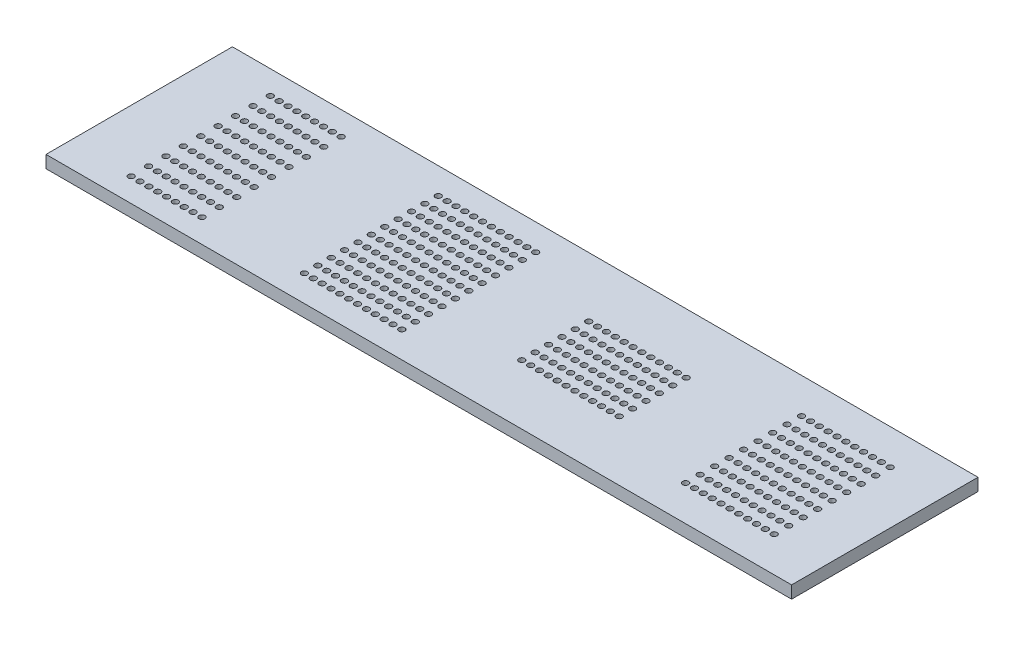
SolidWorks part; units mm, degrees
ref_plane "Plan de face" through (0, 0, 0) normal (0, 0, 1) x (1, 0, 0)
ref_plane "Plan de dessus" through (0, 0, 0) normal (0, 1, 0) x (1, 0, 0)
ref_plane "Plan de droite" through (0, 0, 0) normal (1, 0, 0) x (0, 0, -1)
sketch "Esquisse2" plane through (0, 0, 0) normal (0, 1, 0) x (1, 0, 0)
  line L1 (-60, -15) -> (60, -15)
  line L2 (-60, -15) -> (-60, 15)
  line L3 (-60, 15) -> (60, 15)
  line L4 (60, -15) -> (60, 15)
  line L5 (-60, -15) -> (60, 15) construction
  line L6 (-60, 15) -> (60, -15) construction
  point P0 (0, 0)
  dimension "D1" = 30
  dimension "D2" = 120
extrude "Boss.-Extru.1" add sketch "Esquisse2" along normal blind 2 contours L3 L4 L1 L2
sketch "Cavités" plane through (0, 0, 0) normal (0, 1, 0) x (1, 0, 0)
  line L0 (-60, -15) -> (60, -15) construction
  line L1 (-58.4, 15) -> (-30.4, 15) construction
  line L2 (-58.4, 15) -> (-58.4, -15) construction
  line L3 (-58.4, -15) -> (-30.4, -15) construction
  line L4 (-30.4, 15) -> (-30.4, -15) construction
  line L5 (-60, 15) -> (60, 15) construction
  line L6 (-28.8, 15) -> (-0.8, 15) construction
  line L7 (-28.8, 15) -> (-28.8, -15) construction
  line L8 (-28.8, -15) -> (-0.8, -15) construction
  line L9 (-0.8, 15) -> (-0.8, -15) construction
  line L10 (-30.4, 15) -> (-28.8, 15) construction
  line L11 (0.8, 15) -> (28.8, 15) construction
  line L12 (0.8, 15) -> (0.8, -15) construction
  line L13 (0.8, -15) -> (28.8, -15) construction
  line L14 (28.8, 15) -> (28.8, -15) construction
  line L15 (30.4, 15) -> (58.4, 15) construction
  line L16 (30.4, 15) -> (30.4, -15) construction
  line L17 (30.4, -15) -> (58.4, -15) construction
  line L18 (58.4, 15) -> (58.4, -15) construction
  line L19 (-0.8, 15) -> (0.8, 15) construction
  line L20 (28.8, 15) -> (30.4, 15) construction
  line L21 (-60, 15) -> (-58.4, 15) construction
  line L22 (58.4, 15) -> (60, 15) construction
  dimension "D1" = 28
  dimension "D2" = 1.6
sketch "Esquisse7" plane through (0, 2, 0) normal (0, 1, 0) x (1, 0, 0)
  line L0 (-58.4, 0) -> (-50.096, 0) construction
  line L1 (-50.096, 11.2) -> (-38.704, 11.2) construction
  line L2 (-50.096, 11.2) -> (-50.096, -11.2) construction
  line L3 (-50.096, -11.2) -> (-38.704, -11.2) construction
  line L4 (-38.704, 11.2) -> (-38.704, -11.2) construction
  line L5 (-58.4, 15) -> (-58.4, -15) construction
  line L6 (-38.704, 0) -> (-30.4, 0) construction
  line L7 (-30.4, 15) -> (-30.4, -15) construction
  point P8 (-63, 0)
  dimension "D1" = 11.392
  dimension "D2" = 22.4
sketch "Esquisse8" plane through (0, 2, 0) normal (0, 1, 0) x (1, 0, 0)
  circle A0 centre (-50.096, 11.2) radius 0.475
  dimension "D1" = 0.95
extrude "Enlèv. mat.-Extru.3" cut sketch "Esquisse8" against normal up to next
pattern_linear "Répétition linéaire4" count 9 spacing 1.424 along (1, 0, 0) count 9 spacing 2.8 along (0, 0, 1) of "Enlèv. mat.-Extru.3"
sketch "Esquisse9" plane through (0, 2, 0) normal (0, 1, 0) x (1, 0, 0)
  line L0 (-28.8, 0) -> (-22.6375, 0) construction
  line L1 (-22.6375, 10.77) -> (-6.9625, 10.77) construction
  line L2 (-22.6375, 10.77) -> (-22.6375, -10.77) construction
  line L3 (-22.6375, -10.77) -> (-6.9625, -10.77) construction
  line L4 (-6.9625, 10.77) -> (-6.9625, -10.77) construction
  line L5 (-28.8, 15) -> (-28.8, -15) construction
  line L6 (-6.9625, 0) -> (-0.8, 0) construction
  line L7 (-0.8, 15) -> (-0.8, -15) construction
  dimension "D1" = 15.675
  dimension "D2" = 21.54
sketch "Esquisse10" plane through (0, 2, 0) normal (0, 1, 0) x (1, 0, 0)
  circle A0 centre (-22.6375, 10.77) radius 0.475
  dimension "D1" = 0.95
extrude "Enlèv. mat.-Extru.4" cut sketch "Esquisse10" against normal up to next
pattern_linear "Répétition linéaire5" count 12 spacing 1.425 along (1, 0, 0) count 11 spacing 2.154 along (0, 0, 1) of "Enlèv. mat.-Extru.4"
sketch "Esquisse11" plane through (0, 2, 0) normal (0, 1, 0) x (1, 0, 0)
  line L0 (0.8, 0) -> (6.9625, 0) construction
  line L1 (6.9625, 5.385) -> (22.6375, 5.385) construction
  line L2 (6.9625, 5.385) -> (6.9625, -5.385) construction
  line L3 (6.9625, -5.385) -> (22.6375, -5.385) construction
  line L4 (22.6375, 5.385) -> (22.6375, -5.385) construction
  line L5 (0.8, 15) -> (0.8, -15) construction
  line L6 (22.6375, 0) -> (28.8, 0) construction
  line L7 (28.8, 15) -> (28.8, -15) construction
  dimension "D1" = 15.675
  dimension "D2" = 10.77
sketch "Esquisse12" plane through (0, 2, 0) normal (0, 1, 0) x (1, 0, 0)
  circle A0 centre (6.9625, 5.385) radius 0.475
  dimension "D1" = 0.95
extrude "Enlèv. mat.-Extru.5" cut sketch "Esquisse12" against normal up to next
pattern_linear "Répétition linéaire6" count 12 spacing 1.425 along (1, 0, 0) count 6 spacing 2.154 along (0, 0, 1) of "Enlèv. mat.-Extru.5"
sketch "Esquisse13" plane through (0, 2, 0) normal (0, 1, 0) x (1, 0, 0)
  line L0 (30.4, 0) -> (37.275, 0) construction
  line L1 (37.275, 9.332) -> (51.525, 9.332) construction
  line L2 (37.275, 9.332) -> (37.275, -9.332) construction
  line L3 (37.275, -9.332) -> (51.525, -9.332) construction
  line L4 (51.525, 9.332) -> (51.525, -9.332) construction
  line L5 (30.4, 15) -> (30.4, -15) construction
  line L6 (51.525, 0) -> (58.4, 0) construction
  line L7 (58.4, 15) -> (58.4, -15) construction
  dimension "D1" = 18.664
  dimension "D2" = 14.25
sketch "Esquisse14" plane through (0, 2, 0) normal (0, 1, 0) x (1, 0, 0)
  circle A0 centre (37.275, 9.332) radius 0.475
  dimension "D1" = 0.95
extrude "Enlèv. mat.-Extru.6" cut sketch "Esquisse14" against normal up to next
pattern_linear "Répétition linéaire7" count 11 spacing 1.425 along (1, 0, 0) count 9 spacing 2.333 along (0, 0, 1) of "Enlèv. mat.-Extru.6"
